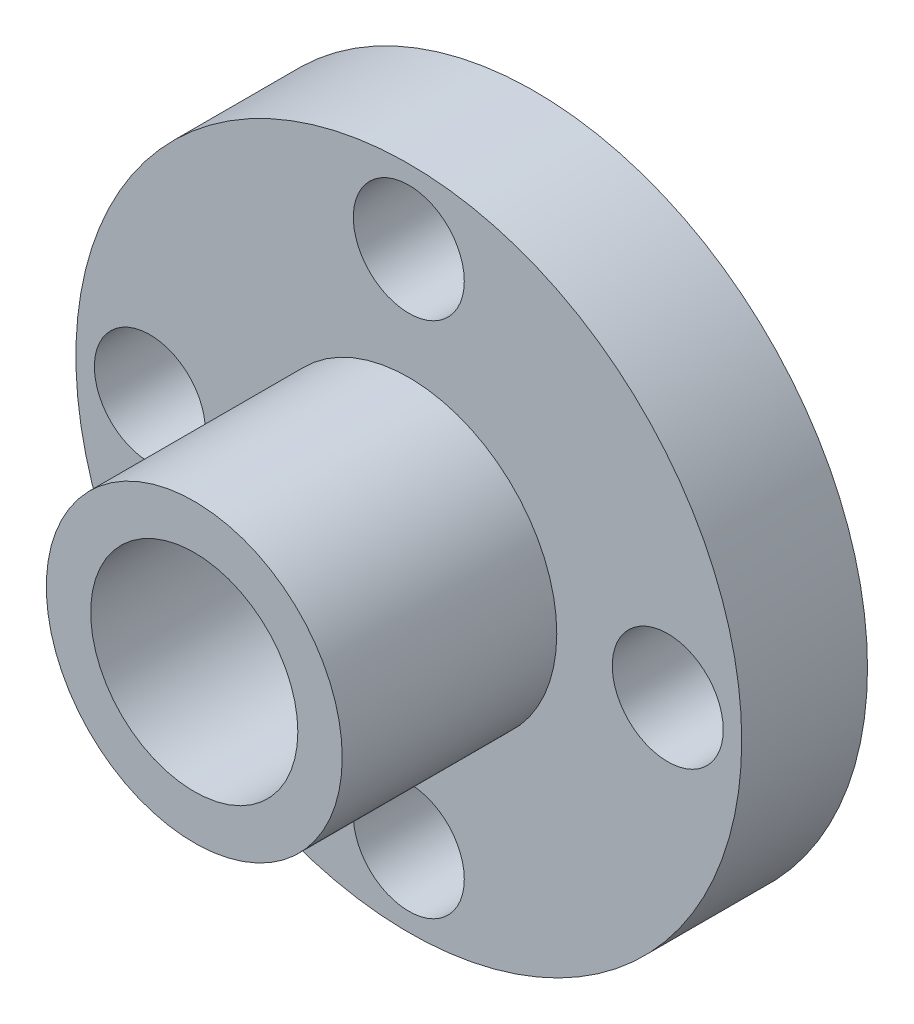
SolidWorks part; units mm, degrees
ref_plane "Front Plane" through (0, 0, 0) normal (0, 0, 1) x (1, 0, 0)
ref_plane "Top Plane" through (0, 0, 0) normal (0, 1, 0) x (1, 0, 0)
ref_plane "Right Plane" through (0, 0, 0) normal (1, 0, 0) x (0, 0, -1)
sketch "Sketch1" plane through (0, 0, 0) normal (1, 0, 0) x (0, 0, -1)
  line L0 (-277.2967, 0) -> (234.0909, 0) construction
  line L5 (0, 0) -> (85, 0)
  line L6 (0, 0) -> (0, 225)
  line L11 (0, 225) -> (85, 225)
  line L12 (85, 0) -> (85, 225)
  line L13 (0, 0) -> (85, 225) construction
  line L14 (0, 225) -> (85, 0) construction
  line L15 (0, 0) -> (-145, 0)
  line L16 (0, 0) -> (0, 100)
  line L17 (0, 100) -> (-145, 100)
  line L18 (-145, 0) -> (-145, 100)
  line L19 (0, 0) -> (-145, 100) construction
  line L20 (0, 100) -> (-145, 0) construction
  point P4 (42.5, 112.5)
  point P8 (-72.5, 50)
  dimension "D1" = 230
  dimension "D2" = 85
revolve "Revolve1" add sketch "Sketch1" angle 360 about L0
sketch "Sketch2" plane through (0, 0, 145) normal (0, 0, 1) x (1, 0, 0)
  line L0 (0, 299.5046) -> (0, -258.5913) construction
  line L1 (-323.1392, 0) -> (377.9237, 0) construction
  circle A0 centre (0, 0) radius 70
  dimension "D1" = 140
extrude "Cut-Extrude1" cut sketch "Sketch2" against normal blind 230 contours A0
sketch "Sketch3" plane through (0, 0, 0) normal (0, 0, 1) x (1, 0, 0)
  line L0 (0, 284.7446) -> (0, -257.2126) construction
  line L1 (-310.1079, 0) -> (344.2598, 0) construction
  circle A2 centre (0, 175) radius 37.5
  circle A3 centre (175, 0) radius 37.5
  circle A4 centre (0, -175) radius 37.5
  circle A5 centre (-175, 0) radius 37.5
  point P14 (0, 0)
  dimension "D1" = 90
  dimension "D2" = 75
  dimension "D3" = 4
other "AlignGroup1"
extrude "Cut-Extrude3" cut sketch "Sketch3" against normal through all contours A2 | A5 | A3 | A4
